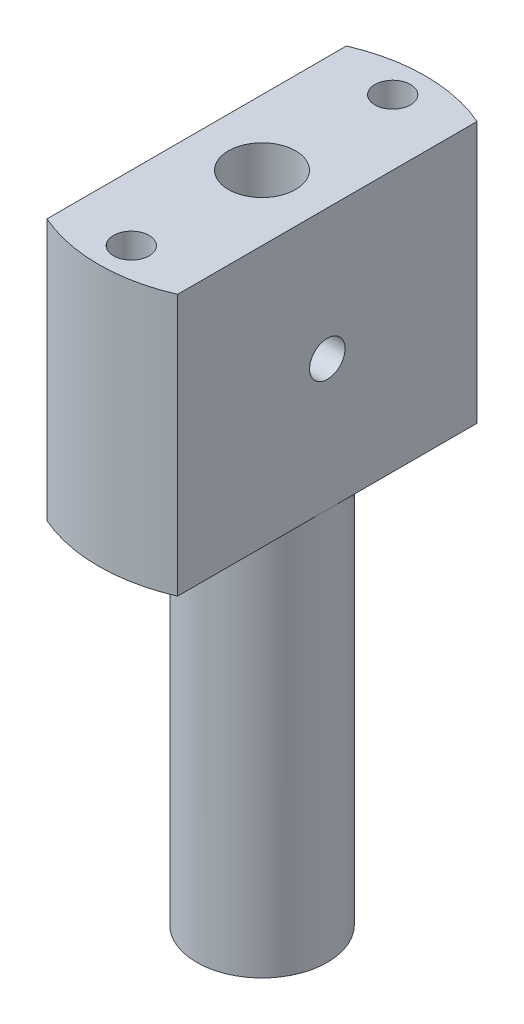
SolidWorks part; units mm, degrees
ref_plane "Front Plane" through (0, 0, 0) normal (0, 0, 1) x (1, 0, 0)
ref_plane "Top Plane" through (0, 0, 0) normal (0, 1, 0) x (1, 0, 0)
ref_plane "Right Plane" through (0, 0, 0) normal (1, 0, 0) x (0, 0, -1)
sketch "Sketch1" plane through (0, 0, 0) normal (0, 1, 0) x (1, 0, 0)
  circle A0 centre (-12.7355, 12.7355) radius 6.35
extrude "Boss-Extrude1" add sketch "Sketch1" along normal blind 38.1
sketch "Sketch12" plane through (0, 38.1, 0) normal (0, 1, 0) x (1, 0, 0)
  circle A0 centre (-12.7355, 12.7355) radius 15.875
  circle A1 centre (-12.7355, 12.7355) radius 6.35 construction
  dimension "D1" = 0
extrude "Boss-Extrude4" add sketch "Sketch12" along normal blind 25.4
hole_wizard "F (0.257) Diameter Hole2" positions "Sketch13" profile "Sketch15" hole size "F" standard "ANSI Inch"
sketch "Sketch13" plane through (0, 63.5, 0) normal (0, 1, 0) x (1, 0, 0)
  circle A0 centre (-12.7355, 12.7355) radius 15.875 construction
  point P0 (-12.7355, 12.7355)
  dimension "D1" = 0
sketch "Sketch15" plane through (-12.7355, 63.5, -12.7355) normal (1, 0, 0) x (0, 0, 1)
  line L0 (0, 0) -> (0, 52.7611)
  line L1 (0, 52.7611) -> (3.2639, 50.8)
  line L2 (3.2639, 50.8) -> (3.2639, 0)
  line L5 (3.2639, 0) -> (0, 0)
  line L10 (0, 52.7611) -> (-3.2639, 50.8) construction
  line L11 (0, -6.35) -> (0, 107.95) construction
  dimension "Hole Dia." = 6.5278
  dimension "Hole Depth" = 50.8
  dimension "Drill Angle" = 118
sketch "Sketch16" plane through (0, 63.5, 0) normal (0, 1, 0) x (1, 0, 0)
  circle A0 centre (-12.7355, 12.7355) radius 6.477
hole_wizard "#8-32 Tapped Hole2" positions "Sketch21" profile "Sketch20" tap size "#8-32" standard "ANSI Inch"
sketch "Sketch21" plane through (0, 63.5, 0) normal (0, 1, 0) x (1, 0, 0)
  point P2 (-12.7355, 25.4355)
  point P10 (-12.7355, 0.0355)
  dimension "D1" = 12.7
  dimension "D2" = 25.4
sketch "Sketch20" plane through (-12.7355, 63.5, -25.4355) normal (1, 0, 0) x (0, 0, 1)
  line L0 (0, 0) -> (0, 63.5)
  line L1 (0, 63.5) -> (1.7272, 63.5)
  line L2 (1.7272, 63.5) -> (1.7272, 0)
  line L5 (1.7272, 0) -> (0, 0)
  line L11 (0, -6.35) -> (0, 107.95) construction
  dimension "Thru Tap Drill Dia." = 3.4544
  dimension "Thru Tap Drill Depth" = 63.5
sketch "Sketch22" plane through (0, 63.5, 0) normal (0, 1, 0) x (1, 0, 0)
  line L1 (-19.0855, 29.2825) -> (-29.4605, 29.2825)
  line L2 (-19.0855, 29.2825) -> (-19.0855, -5.061)
  line L3 (-19.0855, -5.061) -> (-29.4605, -5.061)
  line L4 (-29.4605, 29.2825) -> (-29.4605, -5.061)
  line L5 (-6.3855, 29.2825) -> (5.1557, 29.2825)
  line L6 (-6.3855, 29.2825) -> (-6.3855, -5.061)
  line L7 (-6.3855, -5.061) -> (5.1557, -5.061)
  line L8 (5.1557, 29.2825) -> (5.1557, -5.061)
  dimension "D1" = 6.35
  dimension "D2" = 6.35
extrude "Cut-Extrude1" cut sketch "Sketch22" against normal through all contours L2 L1 L4 L3 | L6 L5 L8 L7
hole_wizard "#8-32 Tapped Hole3" positions "Sketch23" profile "Sketch24" tap size "#8-32" standard "ANSI Inch"
sketch "Sketch23" plane through (-6.3855, 0, 0) normal (1, 0, 0) x (0, 0, -1)
  line L0 (19.2125, 63.5) -> (6.2585, 63.5) construction
  point P0 (12.7355, 50.8)
  dimension "D1" = 12.7
sketch "Sketch24" plane through (-6.3855, 50.8, -12.7355) normal (0, 1, 0) x (0, 0, -1)
  line L0 (0, 0) -> (0, 3.0861)
  line L1 (0, 3.0861) -> (1.7272, 3.0861)
  line L2 (1.7272, 3.0861) -> (1.7272, 0)
  line L5 (1.7272, 0) -> (0, 0)
  line L11 (0, -6.35) -> (0, 107.95) construction
  dimension "Thru Tap Drill Dia." = 3.4544
  dimension "Thru Tap Drill Depth" = 3.0861
